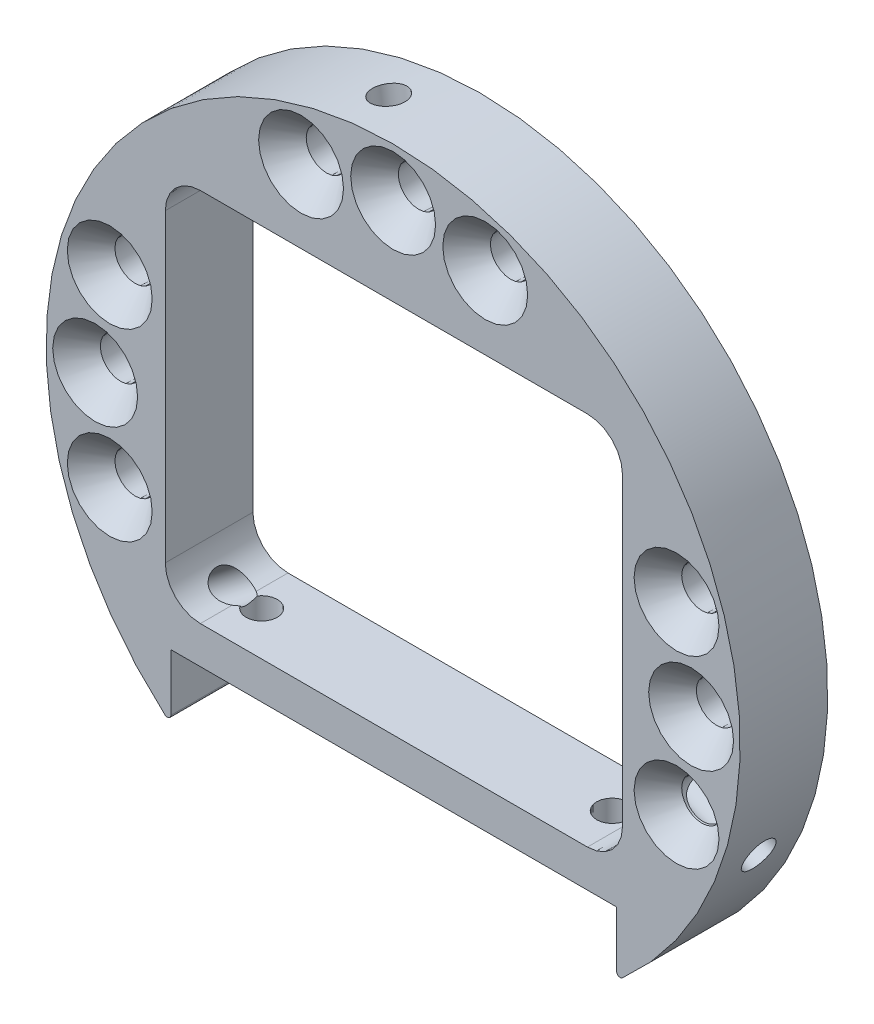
SolidWorks part; units mm, degrees
ref_plane "Front Plane" through (0, 0, 0) normal (0, 0, 1) x (1, 0, 0)
ref_plane "Top Plane" through (0, 0, 0) normal (0, 1, 0) x (1, 0, 0)
ref_plane "Right Plane" through (0, 0, 0) normal (1, 0, 0) x (0, 0, -1)
sketch "Sketch1" plane through (0, 0, 0) normal (0, 0, 1) x (1, 0, 0)
  line L0 (0, 0) -> (-25.146, 0) construction
  line L1 (0, 0) -> (12.573, 21.7771) construction
  line L2 (0, 0) -> (12.573, -21.7771) construction
  circle A0 centre (0, 0) radius 25.146
  dimension "D1" = 50.292
  dimension "D2" = 120
  dimension "D3" = 120
extrude "Boss-Extrude1" add sketch "Sketch1" along normal blind 6.35
sketch "Sketch2" plane through (0, 0, 6.35) normal (0, 0, 1) x (1, 0, 0)
  line L1 (-24.9185, -14.6395) -> (24.0391, -14.6395)
  line L2 (-24.9185, -14.6395) -> (-24.9185, -26.8241)
  line L3 (-24.9185, -26.8241) -> (24.0391, -26.8241)
  line L4 (24.0391, -14.6395) -> (24.0391, -26.8241)
extrude "Cut-Extrude1" cut sketch "Sketch2" against normal blind 4.7625
sketch "Sketch3" plane through (0, 0, 6.35) normal (0, 0, 1) x (1, 0, 0)
  line L1 (29.7951, -26.5733) -> (19.05, -26.5733)
  line L2 (29.7951, -26.5733) -> (29.7951, 23.8125)
  line L3 (29.7951, 23.8125) -> (19.05, 23.8125)
  line L4 (19.05, -26.5733) -> (19.05, 23.8125)
  dimension "D1" = 19.05
extrude "Cut-Extrude3" cut sketch "Sketch3" against normal blind 4.7625
sketch "Sketch5" plane through (0, 0, 6.35) normal (0, 0, 1) x (1, 0, 0)
  line L0 (16.1942, -14.6395) -> (16.1942, -19.2372)
  line L1 (19.05, -14.6395) -> (-20.4452, -14.6395) construction
  line L2 (19.05, -14.6395) -> (20.4452, -14.6395)
  line L3 (16.1942, -14.6395) -> (19.05, -14.6395)
  line L4 (-16.1067, -14.6395) -> (-16.1067, -19.3105)
  line L5 (-20.4452, -14.6395) -> (-16.1067, -14.6395)
  circle A0 centre (0, 0) radius 25.146 construction
  arc A1 (16.1942, -19.2372) -> (20.4452, -14.6395) centre (0, 0) ccw
  arc A2 (-16.1067, -19.3105) -> (-20.4452, -14.6395) centre (0, 0) cw
extrude "Boss-Extrude2" add sketch "Sketch5" against normal blind 4.7625
hole_wizard "#4-40 Tapped Hole1" positions "Sketch6" profile "Sketch7" tap size "#4-40" standard "ANSI Inch"
sketch "Sketch6" plane through (0, -14.6395, 0) normal (0, -1, 0) x (-1, 0, 0)
  line L0 (-16.1942, 0) -> (16.1067, 0) construction
  point P0 (12.7, -3.175)
  point P2 (-12.7, -3.175)
  dimension "D1" = 25.4
  dimension "D2" = 12.7
  dimension "D3" = 3.175
sketch "Sketch7" plane through (-12.7, -14.6395, 3.175) normal (1, 0, 0) x (0, 0, -1)
  line L0 (0, 0) -> (0, 6.7752)
  line L1 (0, 6.7752) -> (1.1303, 6.096)
  line L2 (1.1303, 6.096) -> (1.1303, 0)
  line L5 (1.1303, 0) -> (0, 0)
  line L10 (0, 6.7752) -> (-1.1303, 6.096) construction
  line L11 (0, -6.35) -> (0, 107.95) construction
  dimension "Tap Drill Dia." = 2.2606
  dimension "Tap Drill Depth" = 6.096
  dimension "Drill Angle" = 118
sketch "Sketch8" plane through (0, 0, 6.35) normal (0, 0, 1) x (1, 0, 0)
  line L0 (16.6168, 11.9363) -> (16.6168, 15.4391)
  line L3 (-19.2876, -11.9363) -> (16.6168, -11.9363)
  line L4 (16.6168, 11.9363) -> (16.6168, -11.9363)
  circle A0 centre (0, 0) radius 22.6823 construction
  arc A2 (16.6168, 15.4391) -> (-19.2876, -11.9363) centre (0, 0) ccw
  point P0 (0, 0)
extrude "Cut-Extrude4" cut sketch "Sketch8" against normal blind 6.35
sketch "Sketch9" plane through (0, 0, 6.35) normal (0, 0, 1) x (1, 0, 0)
  line L0 (-14.0723, 17.7892) -> (14.0723, 17.7892)
  circle A0 centre (0, 0) radius 22.6823 construction
  arc A1 (14.0723, 17.7892) -> (-14.0723, 17.7892) centre (0, 0) ccw
extrude "Boss-Extrude3" add sketch "Sketch9" against normal blind 6.35 separate body
combine bodies "Combine1" operation type add bodies to combine 106 107
sketch "Sketch12" plane through (0, 0, 6.35) normal (0, 0, 1) x (1, 0, 0)
  line L0 (19.05, 16.414) -> (19.05, -14.6395) construction
  line L1 (19.05, 16.414) -> (18.1261, 16.414)
  line L2 (18.1261, 16.414) -> (18.1261, -15.0455)
  line L3 (18.1261, -15.0455) -> (20.1483, -15.0455)
  arc A0 (19.05, 16.414) -> (20.1483, -15.0455) centre (0, 0) cw
  point P9 (0, 0)
extrude "Boss-Extrude4" add sketch "Sketch12" against normal up to surface (6.35 mm away)
mirror "Mirror1" about plane through (0, 0, 0) normal (1, 0, 0) of "Boss-Extrude4"
sketch "Sketch13" plane through (0, 0, 6.35) normal (0, 0, 1) x (1, 0, 0)
  line L0 (-16.51, 16.3128) -> (-16.51, -12.6861)
  line L2 (-16.51, -12.6861) -> (-19.239, -12.6541)
  line L3 (-19.239, -12.6541) -> (-19.239, 13.8267)
  line L4 (-19.239, 13.8267) -> (-16.51, 16.3128)
  point P0 (-16.51, 16.3128)
  point P4 (-16.51, 15.4491)
  dimension "D1" = 16.51
extrude "Boss-Extrude7" add sketch "Sketch13" against normal up to surface (6.35 mm away) contours L3 L4 L0 L2
ref_plane "Plane1" through (16.6168, -11.9363, 6.35) normal (1, 0, 0) x (0, 0, -1)
sketch "Sketch14" plane through (0, 0, 6.35) normal (0, 0, 1) x (1, 0, 0)
  line L0 (-17.8389, 15.24) -> (17.6266, 15.24)
  line L1 (17.6266, 15.24) -> (15.248, 17.2787)
  line L2 (15.248, 17.2787) -> (13.7912, 18.6451)
  line L3 (13.7912, 18.6451) -> (-12.9382, 18.6451)
  line L4 (-12.9382, 18.6451) -> (-16.0975, 17.0228)
  line L5 (-16.0975, 17.0228) -> (-17.8389, 15.24)
  point P5 (15.248, 18.5487)
  point P7 (-16.0975, 18.2928)
  point P9 (-12.9545, 19.9068)
  point P10 (13.2518, 19.2697)
  point P11 (13.7912, 18.6451)
  dimension "D1" = 15.24
extrude "Boss-Extrude8" add sketch "Sketch14" against normal up to surface (6.35 mm away)
sketch "Sketch16" plane through (0, 0, 6.35) normal (0, 0, 1) x (1, 0, 0)
  line L1 (-16.51, 20.7015) -> (16.51, 20.7015)
  line L2 (-16.51, 20.7015) -> (-16.51, -12.3185)
  line L3 (-16.51, -12.3185) -> (16.51, -12.3185)
  line L4 (16.51, 20.7015) -> (16.51, -12.3185)
  line L5 (-16.51, 20.7015) -> (16.51, -12.3185) construction
  line L6 (-16.51, -12.3185) -> (16.51, 20.7015) construction
  point P0 (0, 4.1915)
  point P5 (0, 4.1915)
  dimension "D1" = 33.02
  dimension "D2" = 33.02
hole_wizard "CSK for #4 Flat Head Machine Screw (100)1" positions "Sketch10" profile "Sketch11" countersink size "#4" standard "ANSI Inch"
sketch "Sketch10" plane through (0, 0, 6.35) normal (0, 0, 1) x (1, 0, 0)
  point P0 (0, 21.59)
  dimension "D1" = 21.59
sketch "Sketch11" plane through (0, 21.59, 6.35) normal (1, 0, 0) x (0, -1, 0)
  line L0 (0, 0) -> (0, 26.2852)
  line L1 (0, 26.2852) -> (1.4732, 25.4)
  line L2 (1.4732, 25.4) -> (1.4732, 1.8465)
  line L3 (1.4732, 1.8465) -> (3.0783, 0)
  line L5 (3.0783, 0) -> (0, 0)
  line L6 (-1.4732, 1.8465) -> (-3.0783, 0) construction
  line L10 (0, 26.2852) -> (-1.4732, 25.4) construction
  line L11 (0, -6.35) -> (0, 107.95) construction
  dimension "Hole Dia." = 2.9464
  dimension "Hole Depth" = 25.4
  dimension "Near C'Sink Dia." = 6.1566
  dimension "Near C'Sink Angle" = 82
  dimension "Drill Angle" = 118
pattern_circular "CirPattern1" count 4 over 360 about axis through (0, 0, 0) along (0, 0, 1) of "CSK for #4 Flat Head Machine Screw (100)1"
pattern_circular "CirPattern2" count 2 every 18 about axis through (0, 0, 0) along (0, 0, 1) of "CirPattern1", "CSK for #4 Flat Head Machine Screw (100)1"
pattern_circular "CirPattern3" count 2 every 18 about axis through (0, 0, 0) along (0, 0, 1) of "CirPattern1", "CSK for #4 Flat Head Machine Screw (100)1"
fillet "Fillet7" radius 2.54 4 edges at (-16.51, -11.9363, 3.175) (16.6168, -11.9363, 3.175) (16.6168, 15.24, 3.175) (-16.51, 15.24, 3.175)
sketch "Sketch18" plane through (0, 0, 1.5875) normal (0, 0, 1) x (1, 0, 0)
  line L1 (-16.1067, -14.6395) -> (16.1942, -14.6395)
  line L2 (-16.1067, -14.6395) -> (-16.1067, -26.8579)
  line L3 (-16.1067, -26.8579) -> (16.1942, -26.8579)
  line L4 (16.1942, -14.6395) -> (16.1942, -26.8579)
extrude "Cut-Extrude5" cut sketch "Sketch18" against normal through all
fillet "Fillet2" radius 0.254 2 edges at (16.1942, -19.2372, 3.175) (-16.1067, -19.3105, 3.175)
ref_plane "Plane3" through (0, 0, 3.175) normal (0, 0, 1) x (1, 0, 0)
sketch "Sketch21" plane through (0, 0, 3.175) normal (0, 0, 1) x (1, 0, 0)
  line L0 (0, 0) -> (-3.9715, 28.2587)
  line L1 (0, 0) -> (0, 30.0835) construction
  dimension "D1" = 8
ref_plane "Plane2" through (-3.9715, 28.2587, 3.175) normal (-0.1392, 0.9903, 0) x (0.9903, 0.1392, 0)
hole_wizard "#4-48 Tapped Hole1" positions "Sketch19" profile "Sketch20" tap size "#4-48" standard "ANSI Inch"
sketch "Sketch19" plane through (-3.9715, 28.2587, 3.175) normal (-0.1392, 0.9903, 0) x (0.9903, 0.1392, 0)
  point P0 (0, 0)
  dimension "D1" = 3.175
sketch "Sketch20" plane through (-3.9715, 28.2587, 3.175) normal (0, 0, 1) x (-0.9903, -0.1392, 0)
  line L0 (0, 0) -> (0, 19.7635)
  line L1 (0, 19.7635) -> (1.1874, 19.05)
  line L2 (1.1874, 19.05) -> (1.1874, 0)
  line L5 (1.1874, 0) -> (0, 0)
  line L10 (0, 19.7635) -> (-1.1875, 19.05) construction
  line L11 (0, -6.35) -> (0, 107.95) construction
  dimension "Tap Drill Dia." = 2.3749
  dimension "Tap Drill Depth" = 19.05
  dimension "Drill Angle" = 118
pattern_circular "CirPattern4" count 3 over 360 about axis through (0, 0, 6.35) along (0, 0, -1) of "#4-48 Tapped Hole1"
